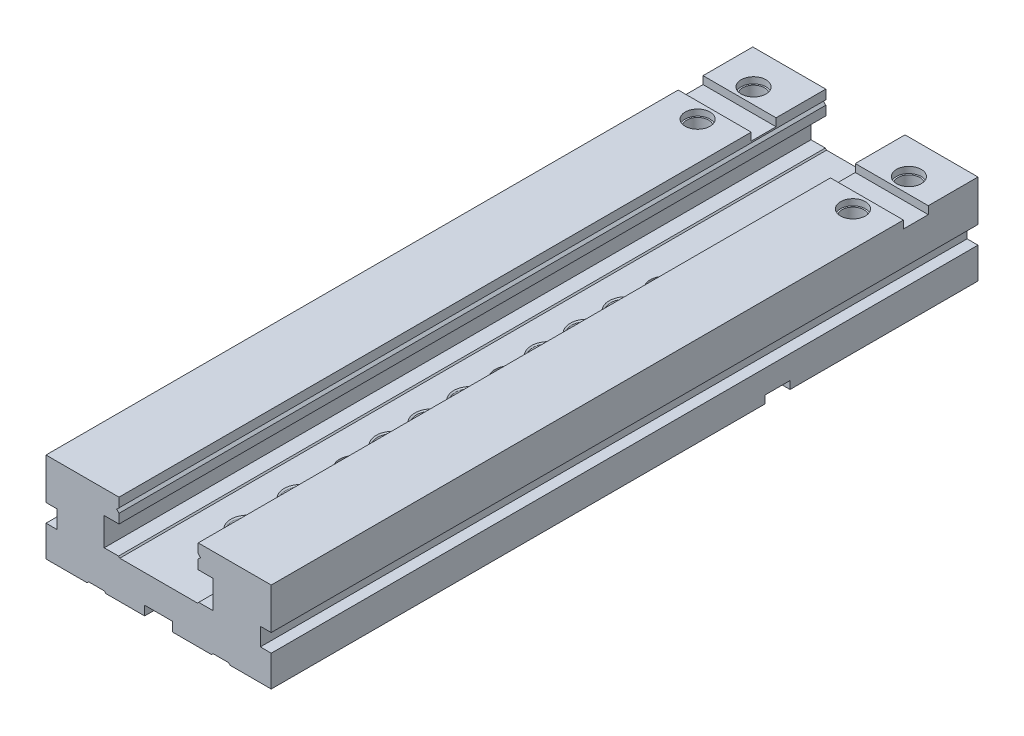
SolidWorks part; units mm, degrees
ref_plane "Front Plane" through (0, 0, 0) normal (0, 0, 1) x (1, 0, 0)
ref_plane "Top Plane" through (0, 0, 0) normal (0, 1, 0) x (1, 0, 0)
ref_plane "Right Plane" through (0, 0, 0) normal (1, 0, 0) x (0, 0, -1)
imported_body "Imported1"
sketch "Sketch2" plane through (0, -4.8, 0) normal (0, 1, 0) x (1, 0, 0)
  circle A0 centre (0, 126) radius 9.5
extrude "Boss-Extrude2" add sketch "Sketch2" against normal up to surface (18.2 mm away)
sketch "Sketch3" plane through (0, -4.8, 0) normal (0, 1, 0) x (1, 0, 0)
  circle A0 centre (0, 326) radius 9.5
  circle A1 centre (0, 226) radius 9.5
extrude "Boss-Extrude3" add sketch "Sketch3" against normal up to surface (18.7 mm away)
hole_wizard "Hole1" positions "Sketch5" profile "Sketch4" legacy
sketch "Sketch5" plane through (0, -4.8, 0) normal (0, 1, 0) x (1, 0, 0)
  line L0 (-25, 455) -> (25, 455) construction
  point P0 (0, 326)
  point P9 (0, 226)
  point P10 (0, 126)
  dimension "D1" = 129
  dimension "D2" = 100
  dimension "D3" = 100
sketch "Sketch4" plane through (0, -4.8, -326) normal (1, 0, 0) x (0, 0, 1)
  line L0 (0, 0) -> (0, 100)
  line L1 (0, 100) -> (6.5, 100)
  line L2 (6.5, 100) -> (6.5, 12.5)
  line L3 (6.5, 12.5) -> (9.5, 12.5)
  line L4 (9.5, 12.5) -> (9.5, 0)
  line L5 (9.5, 0) -> (0, 0)
  line L6 (0, 110) -> (0, -10) construction
  dimension "Diameter" = 13
  dimension "Depth" = 100
  dimension "C-Bore Diameter" = 19
  dimension "C-Bore Depth" = 12.5
